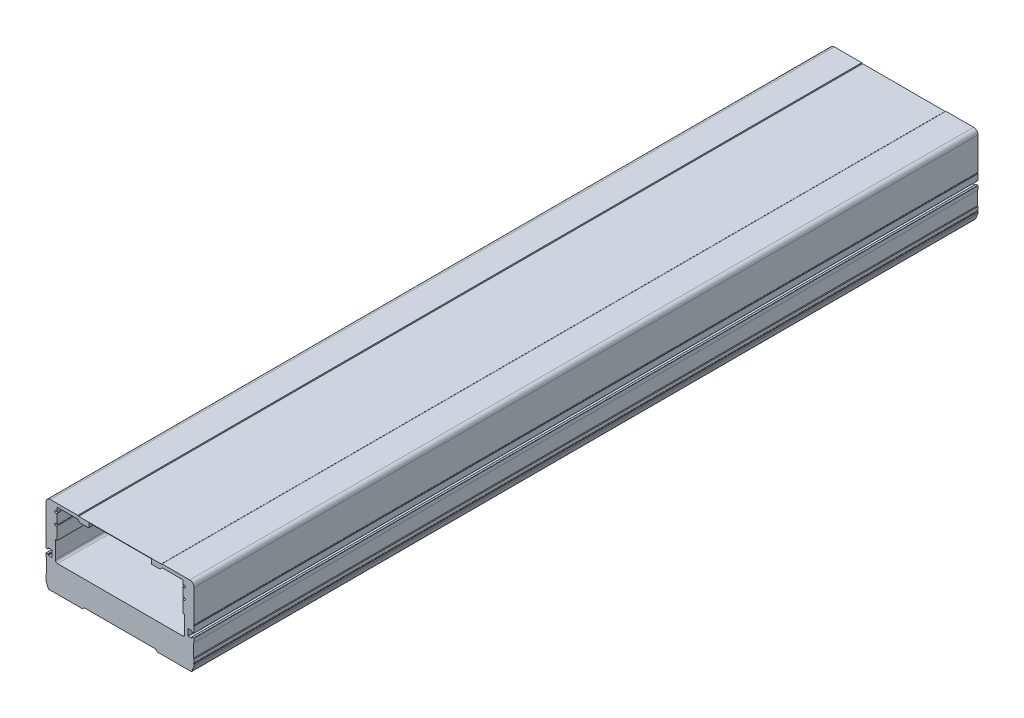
SolidWorks part; units mm, degrees
ref_plane "前视基准面" through (0, 0, 0) normal (0, 0, 1) x (1, 0, 0)
ref_plane "上视基准面" through (0, 0, 0) normal (0, 1, 0) x (1, 0, 0)
ref_plane "右视基准面" through (0, 0, 0) normal (1, 0, 0) x (0, 0, -1)
sketch "草图1" plane through (0, 0, 0) normal (0, 0, 1) x (1, 0, 0)
  line B0 (-57, 22.7) -> (57, 22.7)
  line B1 (-59, 40.3) -> (-59, 24.7)
  line B2 (-57.5, 40.6) -> (-59.3, 40.6)
  line B3 (-57.5, 52.1417) -> (-57.5, 40.6)
  line B4 (-57.5, 62.1417) -> (-57.5, 53.0583)
  line B5 (-57.5, 66.1) -> (-57.5, 63.0583)
  line B6 (-67.5, 66.1) -> (-67.5, 36.6047)
  line B7 (-67.5, 35.3953) -> (-67.5, 30.1)
  line B8 (-67.2, 29.8) -> (-65.8, 29.8)
  line B9 (-65.5, 30.1) -> (-65.5, 30.7)
  line B10 (-65.2, 31) -> (-62.3, 31)
  line B11 (-62, 30.7) -> (-62, 25.3)
  line B12 (-62.3, 25) -> (-65.2, 25)
  line B13 (-65.5, 25.3) -> (-65.5, 25.9)
  line B14 (-65.8, 26.2) -> (-67.2, 26.2)
  line B15 (-67.5, 25.9) -> (-67.5, 22.5)
  line B16 (-67.5, 22.5) -> (-67, 22)
  line B17 (-67, 22) -> (-67, 10)
  line B18 (-67, 10) -> (-67.5, 9.5)
  line B19 (-67.5, 9.5) -> (-67.5, 6.6047)
  line B20 (-67.5, 5.3953) -> (-67.5, 4.382)
  line B21 (-67.3592, 3.6449) -> (-65.5064, -1.0289)
  line B22 (-65.16, -1.6) -> (-34.1, -1.6)
  line B23 (-34.1, -1.6) -> (-32.5, 0)
  line B24 (-32.5, 0) -> (32.5, 0)
  line B25 (32.5, 0) -> (34.1, -1.6)
  line B26 (34.1, -1.6) -> (65.16, -1.6)
  line B27 (65.5064, -1.0289) -> (67.3592, 3.6449)
  line B28 (67.5, 4.382) -> (67.5, 5.3953)
  line B29 (67.5, 6.6047) -> (67.5, 9.5)
  line B30 (67.5, 9.5) -> (67, 10)
  line B31 (67, 10) -> (67, 22)
  line B32 (67, 22) -> (67.5, 22.5)
  line B33 (67.5, 22.5) -> (67.5, 25.9)
  line B34 (67.2, 26.2) -> (65.8, 26.2)
  line B35 (65.5, 25.9) -> (65.5, 25.3)
  line B36 (65.2, 25) -> (62.3, 25)
  line B37 (62, 25.3) -> (62, 30.7)
  line B38 (62.3, 31) -> (65.2, 31)
  line B39 (65.5, 30.7) -> (65.5, 30.1)
  line B40 (65.8, 29.8) -> (67.2, 29.8)
  line B41 (67.5, 30.1) -> (67.5, 35.3953)
  line B42 (67.5, 36.6047) -> (67.5, 66.1)
  line B43 (63.5, 70.1) -> (38.5, 70.1)
  line B44 (38.5, 70.1) -> (38, 69.6)
  line B45 (38, 69.6) -> (37.5, 69.6)
  line B46 (37.5, 69.6) -> (37.5, 69.7)
  line B47 (37.5, 69.7) -> (-37.5, 69.7)
  line B48 (-37.5, 69.7) -> (-37.5, 69.6)
  line B49 (-37.5, 69.6) -> (-38, 69.6)
  line B50 (-38, 69.6) -> (-38.5, 70.1)
  line B51 (-38.5, 70.1) -> (-63.5, 70.1)
  line B52 (-38.5, 67.1) -> (-56.5, 67.1)
  line B53 (-36.5, 65.1) -> (-38.5, 67.1)
  line B54 (-28.8, 65.1) -> (-36.5, 65.1)
  line B55 (-28.5, 69.3) -> (-28.5, 65.4)
  line B56 (28.5, 69.3) -> (-28.5, 69.3)
  line B57 (28.5, 65.4) -> (28.5, 69.3)
  line B58 (36.5, 65.1) -> (28.8, 65.1)
  line B59 (38.5, 67.1) -> (36.5, 65.1)
  line B60 (56.5, 67.1) -> (38.5, 67.1)
  line B61 (57.5, 63.0583) -> (57.5, 66.1)
  line B62 (57.5, 53.0583) -> (57.5, 62.1417)
  line B63 (57.5, 40.6) -> (57.5, 52.1417)
  line B64 (59, 40.6) -> (57.5, 40.6)
  line B65 (59, 24.7) -> (59, 40.6)
  arc B66 (-59, 24.7) -> (-57, 22.7) centre (-57, 24.7) ccw
  arc B67 (-59, 40.3) -> (-59.3, 40.6) centre (-59.3, 40.3) ccw
  arc B68 (-57.5, 53.0583) -> (-57.5, 52.1417) centre (-58.5, 52.6) ccw
  arc B69 (-57.5, 63.0583) -> (-57.5, 62.1417) centre (-58.5, 62.6) ccw
  arc B70 (-56.5, 67.1) -> (-57.5, 66.1) centre (-56.5, 66.1) ccw
  arc B71 (-28.8, 65.1) -> (-28.5, 65.4) centre (-28.8, 65.4) ccw
  arc B72 (28.5, 65.4) -> (28.8, 65.1) centre (28.8, 65.4) ccw
  arc B73 (57.5, 66.1) -> (56.5, 67.1) centre (56.5, 66.1) ccw
  arc B74 (57.5, 62.1417) -> (57.5, 63.0583) centre (58.5, 62.6) ccw
  arc B75 (57.5, 52.1417) -> (57.5, 53.0583) centre (58.5, 52.6) ccw
  arc B76 (57, 22.7) -> (59, 24.7) centre (57, 24.7) ccw
  arc B77 (-67.5, 36.6047) -> (-67.3333, 36.3359) centre (-67.2, 36.6047) ccw
  arc B78 (-67.3333, 35.6641) -> (-67.3333, 36.3359) centre (-67.5, 36) ccw
  arc B79 (-67.3333, 35.6641) -> (-67.5, 35.3953) centre (-67.2, 35.3953) ccw
  arc B80 (-67.5, 30.1) -> (-67.2, 29.8) centre (-67.2, 30.1) ccw
  arc B81 (-65.8, 29.8) -> (-65.5, 30.1) centre (-65.8, 30.1) ccw
  arc B82 (-65.2, 31) -> (-65.5, 30.7) centre (-65.2, 30.7) ccw
  arc B83 (-62, 30.7) -> (-62.3, 31) centre (-62.3, 30.7) ccw
  arc B84 (-62.3, 25) -> (-62, 25.3) centre (-62.3, 25.3) ccw
  arc B85 (-65.5, 25.3) -> (-65.2, 25) centre (-65.2, 25.3) ccw
  arc B86 (-65.5, 25.9) -> (-65.8, 26.2) centre (-65.8, 25.9) ccw
  arc B87 (-67.2, 26.2) -> (-67.5, 25.9) centre (-67.2, 25.9) ccw
  arc B88 (-67.5, 6.6047) -> (-67.3333, 6.3359) centre (-67.2, 6.6047) ccw
  arc B89 (-67.3333, 5.6641) -> (-67.3333, 6.3359) centre (-67.5, 6) ccw
  arc B90 (-67.3333, 5.6641) -> (-67.5, 5.3953) centre (-67.2, 5.3953) ccw
  arc B91 (-67.5, 4.382) -> (-67.3592, 3.6449) centre (-65.5, 4.382) ccw
  arc B92 (-65.5064, -1.0289) -> (-65.16, -1.6) centre (-63.6472, -0.2918) ccw
  arc B93 (65.16, -1.6) -> (65.5064, -1.0289) centre (63.6472, -0.2918) ccw
  arc B94 (67.3592, 3.6449) -> (67.5, 4.382) centre (65.5, 4.382) ccw
  arc B95 (67.5, 5.3953) -> (67.3333, 5.6641) centre (67.2, 5.3953) ccw
  arc B96 (67.3333, 6.3359) -> (67.3333, 5.6641) centre (67.5, 6) ccw
  arc B97 (67.3333, 6.3359) -> (67.5, 6.6047) centre (67.2, 6.6047) ccw
  arc B98 (67.5, 25.9) -> (67.2, 26.2) centre (67.2, 25.9) ccw
  arc B99 (65.8, 26.2) -> (65.5, 25.9) centre (65.8, 25.9) ccw
  arc B100 (65.2, 25) -> (65.5, 25.3) centre (65.2, 25.3) ccw
  arc B101 (62, 25.3) -> (62.3, 25) centre (62.3, 25.3) ccw
  arc B102 (62.3, 31) -> (62, 30.7) centre (62.3, 30.7) ccw
  arc B103 (65.5, 30.7) -> (65.2, 31) centre (65.2, 30.7) ccw
  arc B104 (65.5, 30.1) -> (65.8, 29.8) centre (65.8, 30.1) ccw
  arc B105 (67.2, 29.8) -> (67.5, 30.1) centre (67.2, 30.1) ccw
  arc B106 (67.5, 35.3953) -> (67.3333, 35.6641) centre (67.2, 35.3953) ccw
  arc B107 (67.3333, 36.3359) -> (67.3333, 35.6641) centre (67.5, 36) ccw
  arc B108 (67.3333, 36.3359) -> (67.5, 36.6047) centre (67.2, 36.6047) ccw
  arc B109 (67.5, 66.1) -> (63.5, 70.1) centre (63.5, 66.1) ccw
  arc B110 (-63.5, 70.1) -> (-67.5, 66.1) centre (-63.5, 66.1) ccw
sketch_block_instance "块1-1"
sketch_block "块1"
extrude "凸台-拉伸1" add sketch "草图1" along normal blind 715
hole_wizard "M6 螺纹孔1" positions "草图2" profile "草图3" tap size "M6" standard "GB"
sketch "草图2" plane through (0, -1.6, 0) normal (0, -1, 0) x (-1, 0, 0)
  line L0 (0, -715) -> (0, -464.3791) construction
  line L3 (32.5, -715) -> (-32.5, -715) construction
  line L4 (65.16, -715) -> (34.1, -715) construction
  point P0 (53, -663.5)
  point P9 (-53, -663.5)
  point P13 (53, -613.5)
  point P15 (53, -413.5)
  point P17 (53, -213.5)
  point P19 (53, -13.5)
  point P21 (53, 186.5)
  point P23 (53, 386.5)
  point P27 (-53, 186.5)
  point P28 (-53, -13.5)
  point P29 (-53, -213.5)
  point P30 (-53, -413.5)
  point P31 (-53, -613.5)
  dimension "D1" = 106
  dimension "D2" = 51.5
  dimension "D3" = 50
  dimension "D4" = 200
  dimension "D5" = 200
  dimension "D6" = 200
  dimension "D7" = 200
  dimension "D8" = 200
sketch "草图3" plane through (-53, -1.6, 663.5) normal (1, 0, 0) x (0, 0, -1)
  line L0 (0, 0) -> (0, 13.5022)
  line L1 (0, 13.5022) -> (2.5, 12)
  line L2 (2.5, 12) -> (2.5, 0)
  line L5 (2.5, 0) -> (0, 0)
  line L10 (0, 13.5022) -> (-2.5, 12) construction
  line L11 (0, -6.35) -> (0, 107.95) construction
  dimension "螺纹孔钻头直径" = 5
  dimension "螺纹孔钻头深度" = 12
  dimension "导头角度" = 118
